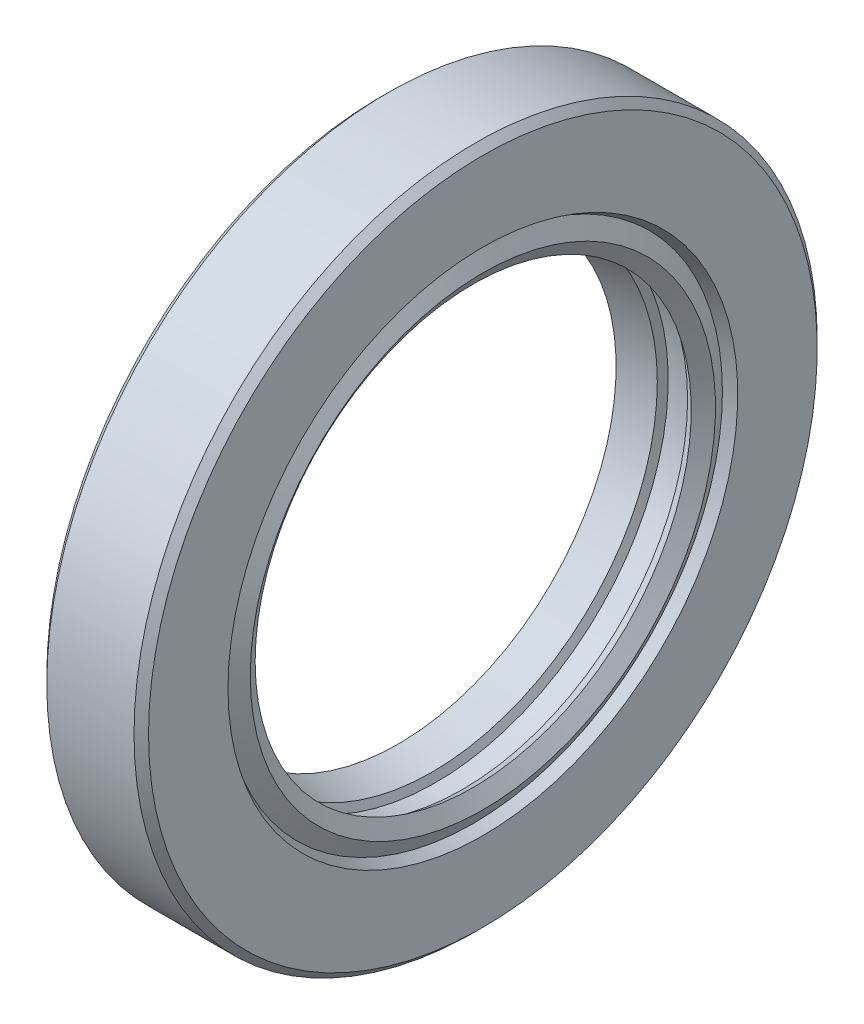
SolidWorks part; units mm, degrees
ref_plane "Plan1" through (0, 0, 0) normal (0, 0, 1) x (1, 0, 0)
ref_plane "Plan2" through (0, 0, 0) normal (0, 1, 0) x (1, 0, 0)
ref_plane "Plan3" through (0, 0, 0) normal (1, 0, 0) x (0, 0, -1)
sketch "Esquisse1" plane through (0, 0, 0) normal (0, 0, 1) x (1, 0, 0)
  line L0 (0, 0) -> (45, 0) construction
  line L1 (0, 21.5) -> (4, 21.2143)
  line L2 (0.5, 23.5) -> (6.5, 23.5)
  line L3 (0, 23) -> (0, 21.5)
  line L4 (1.1667, 15) -> (3.5, 15.5)
  line L5 (7, 23) -> (7, 17.5348)
  line L6 (4, 21.2143) -> (4, 17.8624)
  line L7 (7, 16) -> (6.3333, 17.1474)
  line L8 (0.5, 18) -> (0.5, 16)
  line L9 (0.5, 18) -> (1.134, 18)
  line L10 (0.5, 16) -> (1.1667, 15)
  line L11 (3.75, 16) -> (5.2917, 16)
  line L12 (7, 16) -> (6.3333, 15)
  line L14 (3.5, 15.5) -> (3.75, 16)
  line L15 (6.3333, 15) -> (5.5833, 15.5)
  line L16 (5.5833, 15.5) -> (5.2917, 16)
  line L18 (6.3333, 17.1474) -> (7, 17.5348)
  line L19 (0.5, 23.5) -> (0, 23)
  line L20 (7, 23) -> (6.5, 23.5)
  line L21 (2.9858, 17.6681) -> (4, 17.8624)
  arc A0 (2.9858, 17.6681) -> (1.134, 18) centre (2, 17.5) ccw
revolve "Base-Révolution" add sketch "Esquisse1" angle 360 about L0
